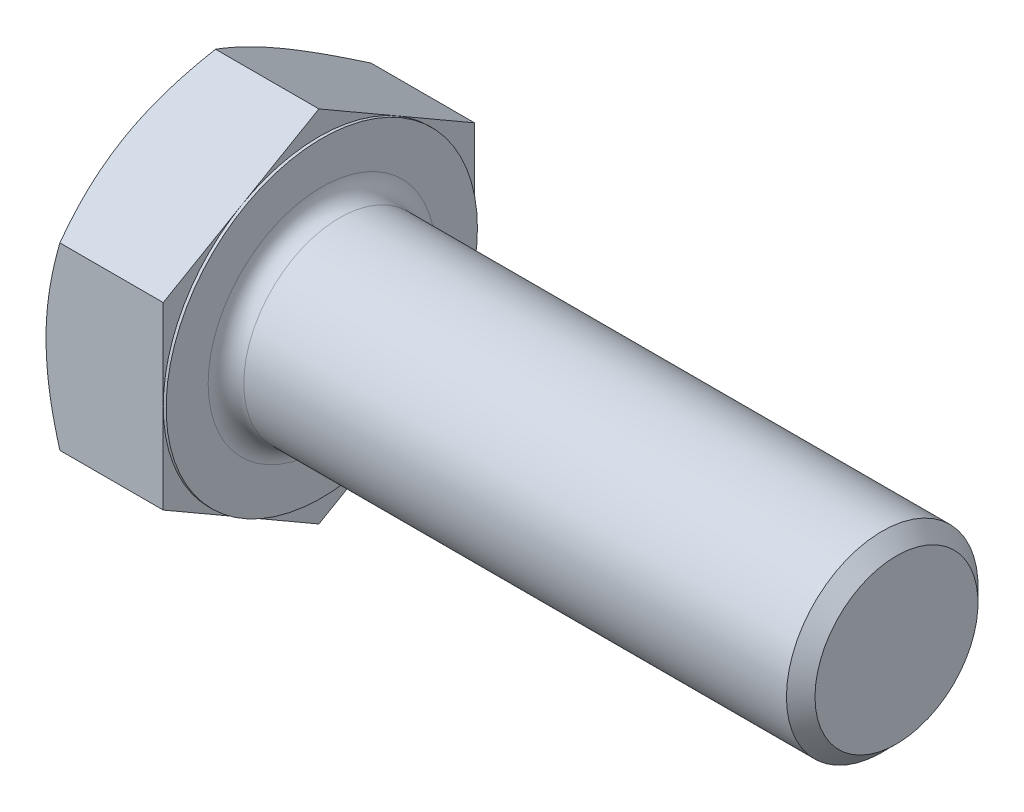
SolidWorks part; units mm, degrees
extrude "BaseHead" add sketch "Sketch1" along normal blind 15.9258
sketch "Sketch1" plane through (0, 0, 0) normal (1, 0, 0) x (0, 0, -1)
  line L0 (20.6375, 11.9151) -> (20.6375, -11.9151)
  line L1 (-20.6375, 11.9151) -> (-20.6375, -11.9151)
  line L2 (20.6375, -11.9151) -> (0, -23.8301)
  line L3 (0, -23.8301) -> (-20.6375, -11.9151)
  line L4 (20.6375, 11.9151) -> (0, 23.8301)
  line L5 (0, 23.8301) -> (-20.6375, 11.9151)
revolve "HeadChamfer" cut sketch "Sketch3" angle 360 about L6
sketch "Sketch3"
ref_plane "Plane1" through (0, 0, 0) normal (0, 0, 1) x (1, 0, 0)
ref_plane "Plane2" through (0, 0, 0) normal (0, 1, 0) x (1, 0, 0)
ref_plane "Plane3" through (0, 0, 0) normal (1, 0, 0) x (0, 0, -1)
other "Configuration Table"
sketch "BodySke" plane through (0, 0, 0) normal (0, 0, 1) x (1, 0, 0)
  line L0 (0, 11.9151) -> (0, -11.9151) construction
  line L1 (0, 0) -> (92.1258, 0)
  line L2 (0, 0) -> (0, 12.7)
  line L3 (0, 12.7) -> (90.2335, 12.7)
  line L4 (92.1258, 0) -> (92.1258, 10.8077)
  line L5 (15.9258, 23.8301) -> (15.9258, 11.9151) construction
  line L6 (92.1258, 10.8077) -> (90.2335, 12.7)
  line L7 (0, 0) -> (96.52, 0) construction
  line L8 (92.1258, -10.8077) -> (90.2335, -12.7) construction
  line L9 (0, -12.7) -> (90.2335, -12.7) construction
  line L10 (18.034, 15.24) -> (18.034, -1.27) construction
  line L11 (60.3758, 15.24) -> (60.3758, -1.27) construction
  line L12 (15.9258, 11.9151) -> (15.9258, -11.9151) construction
revolve "BaseBody" add sketch "BodySke" angle 360 about L7
sketch "Sketch4"
revolve "BearingFace" cut sketch "Sketch4" angle 360 about L5
fillet "HeadFillet" radius 2.3622 1 edges at (15.9258, 0, -12.7)
sketch "ThdSchSke" plane through (0, 0, 0) normal (0, 0, 1) x (1, 0, 0)
  line L0 (60.3758, -10.8077) -> (59.0508, -12.7)
  line L1 (60.3758, -10.8077) -> (61.7008, -12.7)
  line L2 (61.7008, -12.7) -> (61.7008, -15.875)
  line L3 (-3.175, 0) -> (5.1513, 0) construction
  line L5 (61.7008, -15.875) -> (59.0508, -15.875)
  line L6 (59.0508, -15.875) -> (59.0508, -12.7)
revolve "ThreadSchematic" [suppressed] cut sketch "ThdSchSke" angle 360 about L3
pattern_linear "ThdSchPat" [suppressed]
equation "\"D3@Sketch1\" = \"Width_flats@Sketch1\" / 2"
equation "\"D4@Sketch1\" = \"D3@Sketch1\""
equation "\"D5@Sketch1\" = \"D4@Sketch1\""
equation "\"Thread_minor@ThreadCosmetic\" = \"Minor_dia@BodySke\""
equation "\"D1@Sketch3\" = \"Width_flats@Sketch1\" / 2"
equation "\"D1@Sketch4\" = \"Width_flats@Sketch1\" / 2"
equation "\"Thread_length@ThreadCosmetic\" = ((sgn( (\"Length@BodySke\" - \"Advance@BodySke\" ) - \"Thread_nom@BodySke\" )-1)*( (\"Length@BodySke\" - \"Advance@BodySke\" ) - \"Thread_nom@BodySke\" ))/-2+ \"Thread_nom@BodySke\""
equation "\"Thread_minor@ThdSchSke\" = \"Minor_dia@BodySke\""
equation "\"Diameter@ThdSchSke\" = \"Diameter@BodySke\""
equation "\"Overcut@ThdSchSke\" = \"Diameter@BodySke\" * 1.25"
equation "\"Start@ThdSchSke\" = \"Head_ht@BaseHead\" + \"Length@BodySke\" - \"Thread_length@ThreadCosmetic\"  '---Non-countersunk---"
equation "\"Num_threads@ThdSchPat\" = int( \"Thread_length@ThreadCosmetic\" / \"Advance@BodySke\" + 0.999 )  + 1"
equation "\"Advance@ThdSchPat\" = \"Thread_length@ThreadCosmetic\" /  (\"Num_threads@ThdSchPat\" - 1) 'relax it"
equation "\"Num_threads@ThdSchPat\" = \"Num_threads@ThdSchPat\" - sgn( \"Num_threads@ThdSchPat\" - 1) '---chamfered tips only---"
